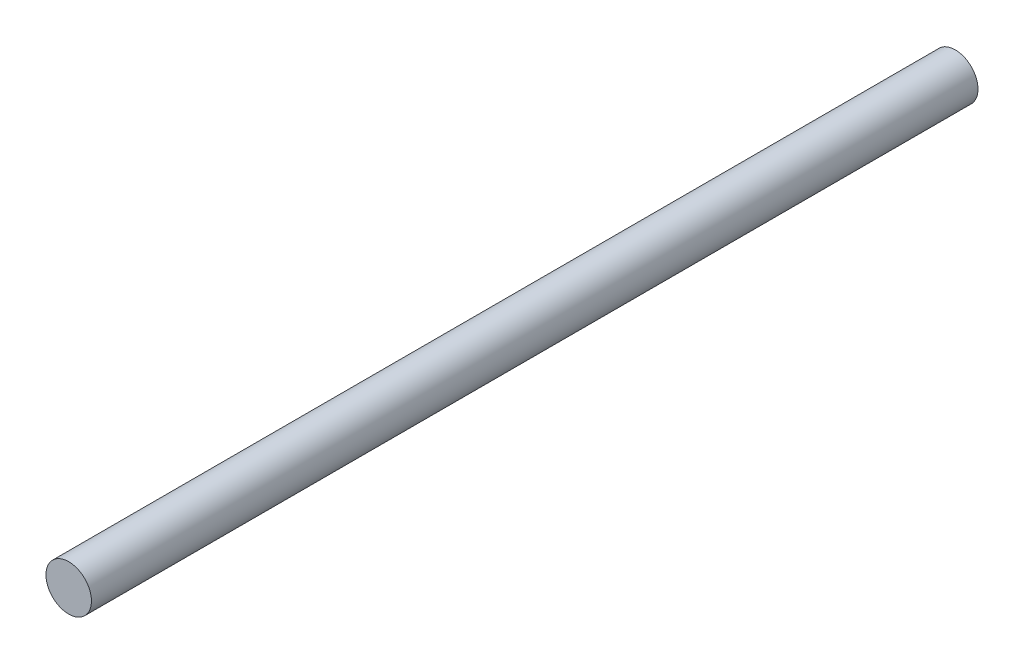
SolidWorks part; units mm, degrees
ref_plane "Plan de face" through (0, 0, 0) normal (0, 0, 1) x (1, 0, 0)
ref_plane "Plan de dessus" through (0, 0, 0) normal (0, 1, 0) x (1, 0, 0)
ref_plane "Plan de droite" through (0, 0, 0) normal (1, 0, 0) x (0, 0, -1)
sketch "Esquisse1" plane through (0, 0, 0) normal (0, 0, 1) x (1, 0, 0)
  circle A0 centre (0, 0) radius 10
  dimension "D1" = 20
extrude "Boss.-Extru.1" add sketch "Esquisse1" along normal blind 390
